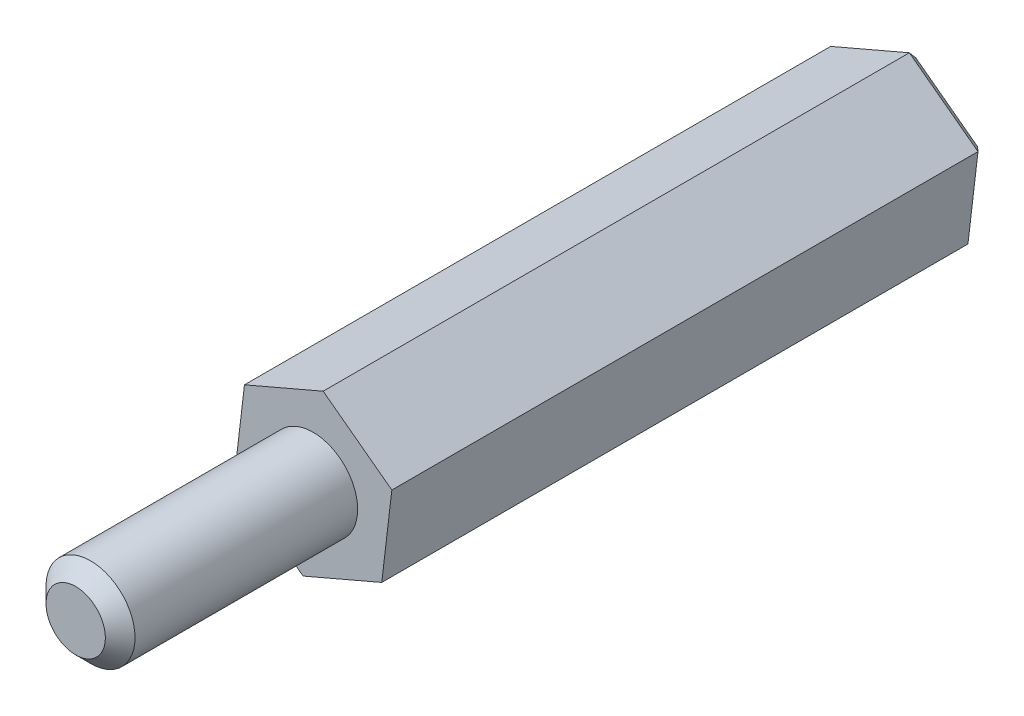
SolidWorks part; units mm, degrees
ref_plane "Plan de face" through (0, 0, 0) normal (0, 0, 1) x (1, 0, 0)
ref_plane "Plan de dessus" through (0, 0, 0) normal (0, 1, 0) x (1, 0, 0)
ref_plane "Plan de droite" through (0, 0, 0) normal (1, 0, 0) x (0, 0, -1)
sketch "Esquisse1" plane through (0, 0, 0) normal (0, 0, 1) x (1, 0, 0)
  line L1 (-2.6522, -1.1397) -> (-0.3391, -2.8668)
  line L2 (-0.3391, -2.8668) -> (2.3132, -1.727)
  line L3 (2.3132, -1.727) -> (2.6522, 1.1397)
  line L4 (2.6522, 1.1397) -> (0.3391, 2.8668)
  line L5 (0.3391, 2.8668) -> (-2.3132, 1.727)
  line L6 (-2.3132, 1.727) -> (-2.6522, -1.1397)
  circle A0 centre (0, 0) radius 2.5 construction
  dimension "D1" = 5
extrude "Boss.-Extru.1" add sketch "Esquisse1" along normal blind 20
sketch "Esquisse2" plane through (0, 0, 20) normal (0, 0, 1) x (1, 0, 0)
  circle A0 centre (0, 0) radius 1.5
extrude "Boss.-Extru.2" add sketch "Esquisse2" along normal blind 8
chamfer "Chanfrein1" distance 0.5 angle 45 1 edges at (1.5, 0, 28)
sketch "Esquisse3" plane through (0, 0, 0) normal (0, 0, -1) x (-1, 0, 0)
  circle A0 centre (0, 0) radius 1.5
extrude "Enlèv. mat.-Extru.1" cut sketch "Esquisse3" against normal blind 10
chamfer "Chanfrein2" distance 0.5 angle 45 1 edges at (-1.5, 0, 0)
chamfer "Chanfrein3" distance 0.25 angle 45 6 edges at (-1.4956, -2.0033, 0) (0.987, -2.2969, 0) (2.4827, -0.2936, 0) (1.4956, 2.0033, 0) (-0.987, 2.2969, 0) (-2.4827, 0.2936, 0)
